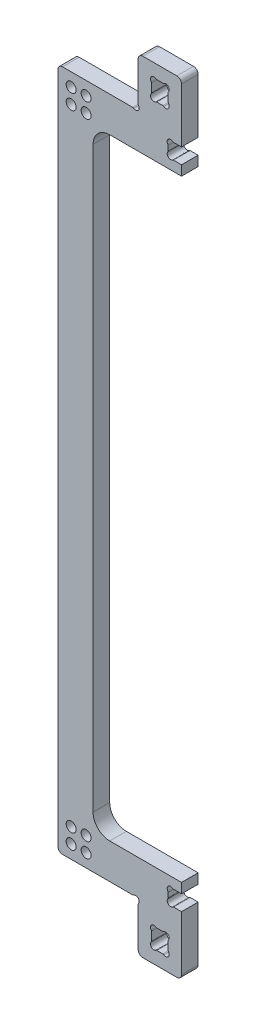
SolidWorks part; units mm, degrees
ref_plane "Plan de face" through (0, 0, 0) normal (0, 0, 1) x (1, 0, 0)
ref_plane "Plan de dessus" through (0, 0, 0) normal (0, 1, 0) x (1, 0, 0)
ref_plane "Plan de droite" through (0, 0, 0) normal (1, 0, 0) x (0, 0, -1)
sketch "Esquisse2" plane through (0, 0, 0) normal (0, 0, 1) x (1, 0, 0)
  line L0 (0, 74.1667) -> (-3.6062, 70.5604) construction
  line L1 (0, 0) -> (65.2, 0)
  line L2 (0, 0) -> (0, 66.0356)
  line L3 (45.1, 100.6667) -> (56.7, 100.6667) construction
  line L4 (65.2, 89.0667) -> (53.231, 89.0667)
  line L5 (45.1, 97.1977) -> (45.1, 104.1356)
  line L6 (45.1, 89.0667) -> (56.7, 100.6667) construction
  line L7 (-8.131, 74.1667) -> (-120.8, 74.1667)
  line L8 (-42.8, 127.1667) -> (-42.8, 74.1667) construction
  line L9 (-42.8, 127.1667) -> (65.2, 127.1667)
  line L10 (65.2, 112.2667) -> (53.231, 112.2667)
  line L11 (65.2, 89.0667) -> (65.2, 0)
  line L12 (65.2, 127.1667) -> (65.2, 112.2667)
  line L13 (-120.8, 74.1667) -> (-120.8, 587)
  line L14 (-67.8, 152.1667) -> (-67.8, 587)
  line L15 (-67.8, 587) -> (-120.8, 587)
  line L16 (-120.8, 0) -> (-120.8, 1174) construction
  line L17 (32.6, 0) -> (32.6, 20) construction
  line L18 (-67.8, 152.1667) -> (-120.8, 152.1667) construction
  line L19 (45.2, 41.0356) -> (45.2, 28.131)
  line L20 (28.131, 49.1667) -> (37.069, 49.1667)
  line L21 (20, 34.5833) -> (45.2, 34.5833) construction
  line L22 (20, 41.0356) -> (20, 28.131)
  line L23 (28.131, 20) -> (37.069, 20)
  line L24 (20, 20) -> (32.6, 32.6) construction
  line L25 (45.1, 100.6667) -> (-42.8, 100.6667) construction
  line L26 (45.1, 112.2667) -> (45.1, 104.1356) construction
  line L27 (45.1, 112.2667) -> (53.231, 112.2667) construction
  line L28 (45.2, 89.1667) -> (45.2, 112.1667) construction
  line L29 (45.2, 112.1667) -> (65.2, 112.1667) construction
  line L30 (45.2, 89.1667) -> (65.2, 89.1667) construction
  arc A0 (0.4914, 67.524) -> (-6.6426, 74.658) centre (-3.6062, 70.5604) ccw
  arc A1 (0, 66.0356) -> (0.4914, 67.524) centre (2.5, 66.0356) cw
  arc A2 (-6.6426, 74.658) -> (-8.131, 74.1667) centre (-8.131, 76.6667) cw
  arc A3 (44.6086, 95.7093) -> (51.7426, 88.5753) centre (48.7062, 92.6729) ccw
  arc A4 (51.7426, 88.5753) -> (53.231, 89.0667) centre (53.231, 86.5667) cw
  arc A5 (44.6086, 95.7093) -> (45.1, 97.1977) centre (42.6, 97.1977) ccw
  arc A6 (44.6086, 105.624) -> (45.1, 104.1356) centre (42.6, 104.1356) cw
  arc A7 (44.6086, 105.624) -> (51.7426, 112.758) centre (48.7062, 108.6604) cw
  arc A8 (51.7426, 112.758) -> (53.231, 112.2667) centre (53.231, 114.7667) ccw
  arc A9 (-67.8, 152.1667) -> (-42.8, 127.1667) centre (-42.8, 152.1667) ccw
  arc A10 (19.5086, 26.6426) -> (26.6426, 19.5086) centre (23.6062, 23.6062) ccw
  arc A11 (19.5086, 26.6426) -> (20, 28.131) centre (17.5, 28.131) ccw
  arc A12 (26.6426, 19.5086) -> (28.131, 20) centre (28.131, 17.5) cw
  arc A13 (38.5574, 19.5086) -> (37.069, 20) centre (37.069, 17.5) ccw
  arc A14 (45.6914, 26.6426) -> (38.5574, 19.5086) centre (41.5938, 23.6062) cw
  arc A15 (45.6914, 26.6426) -> (45.2, 28.131) centre (47.7, 28.131) cw
  arc A16 (45.6914, 42.524) -> (45.2, 41.0356) centre (47.7, 41.0356) ccw
  arc A17 (45.6914, 42.524) -> (38.5574, 49.658) centre (41.5938, 45.5604) ccw
  arc A18 (38.5574, 49.658) -> (37.069, 49.1667) centre (37.069, 51.6667) cw
  arc A19 (26.6426, 49.658) -> (28.131, 49.1667) centre (28.131, 51.6667) ccw
  arc A20 (19.5086, 42.524) -> (26.6426, 49.658) centre (23.6062, 45.5604) cw
  arc A21 (19.5086, 42.524) -> (20, 41.0356) centre (17.5, 41.0356) cw
  point P43 (-120.8, 587)
  point P63 (32.6, 20)
  point P84 (45.2, 100.6667)
extrude "Boss.-Extru.2" add sketch "Esquisse2" along normal blind 25
sketch "Esquisse3" plane through (0, 0, 25) normal (0, 0, 1) x (1, 0, 0)
  line L0 (-120.8, 74.1667) -> (-8.131, 74.1667) construction
  line L2 (-120.8, 587) -> (-120.8, 74.1667) construction
  line L3 (-100.8, 94.1667) -> (-78.3, 94.1667) construction
  line L4 (-100.8, 94.1667) -> (-100.8, 116.6667) construction
  circle A0 centre (-100.8, 94.1667) radius 7.5
  circle A1 centre (-78.3, 94.1667) radius 7.5
  circle A2 centre (-78.3, 116.6667) radius 7.5
  circle A3 centre (-100.8, 116.6667) radius 7.5
extrude "Enlèv. mat.-Extru.2" cut sketch "Esquisse3" against normal through all
fillet "Congé1" radius 7 3 edges at (0, 0, 12.5) (65.2, 0, 12.5) (-120.8, 74.1667, 12.5)
mirror "Symétrie1" about plane through (-67.8, 587, 25) normal (0, -1, 0)
equation "\"D1@Boss.-Extru.2\" = \"material_thickness\""
equation "\"D4@Esquisse2\"= \"tool_diameter\" / 2 + \"hole_clearance\""
equation "\"D5@Esquisse2\"=\"angle\""
equation "\"tool_diameter\"=10"
equation "\"hole_clearance\"=0.1"
equation "\"material_thickness\"=25"
equation "\"clearance\"=0.1"
equation "\"outer_slot\"=0.5"
equation "\"fillet\"=7"
equation "\"D7@Esquisse2\"=\"material_thickness\"/10"
equation "\"string\"= 2 * \"tool_diameter\" / 2 * cos ( 45deg )"
equation "\"angle\"= IIF ( \"string\" < \"limit\" , 45 , ( 180 - 2 * arcsin ( \"ThicknessVStool_dia\" ) ) / 2 )"
equation "\"limit\"= \"material_thickness\" / 2 * 5 / 6"
equation "\"ThicknessVStool_dia\"= IIF ( \"limit\" / \"tool_diameter\" > 1 , 1 , \"limit\" / \"tool_diameter\" )"
equation "\"D1@Congé1\"=\"fillet\""
equation "\"D8@Esquisse2\"=\"material_thickness\"/10"
equation "\"D6@Esquisse2\"=\"tool_diameter\"/2 + \"hole_clearance\""
equation "\"D6@Esquisse3\"=\"D3@Esquisse3\"*3/2"
equation "\"D7@Esquisse3\"=\"D6@Esquisse3\""
equation "\"D19@Esquisse2\"=\"material_thickness\""
equation "\"D13@Esquisse2\"=\"material_thickness\"/2 + \"clearance\""
equation "\"D11@Esquisse2\"=\"material_thickness\"/2*7/6"
equation "\"D15@Esquisse2\"=\"tool_diameter\"/2 +\"hole_clearance\""
equation "\"D16@Esquisse2\"=\"material_thickness\"/10"
equation "\"D20@Esquisse2\"=\"clearance\""
equation "\"D21@Esquisse2\"=\"clearance\""
equation "\"D23@Esquisse2\"=\"angle\""
